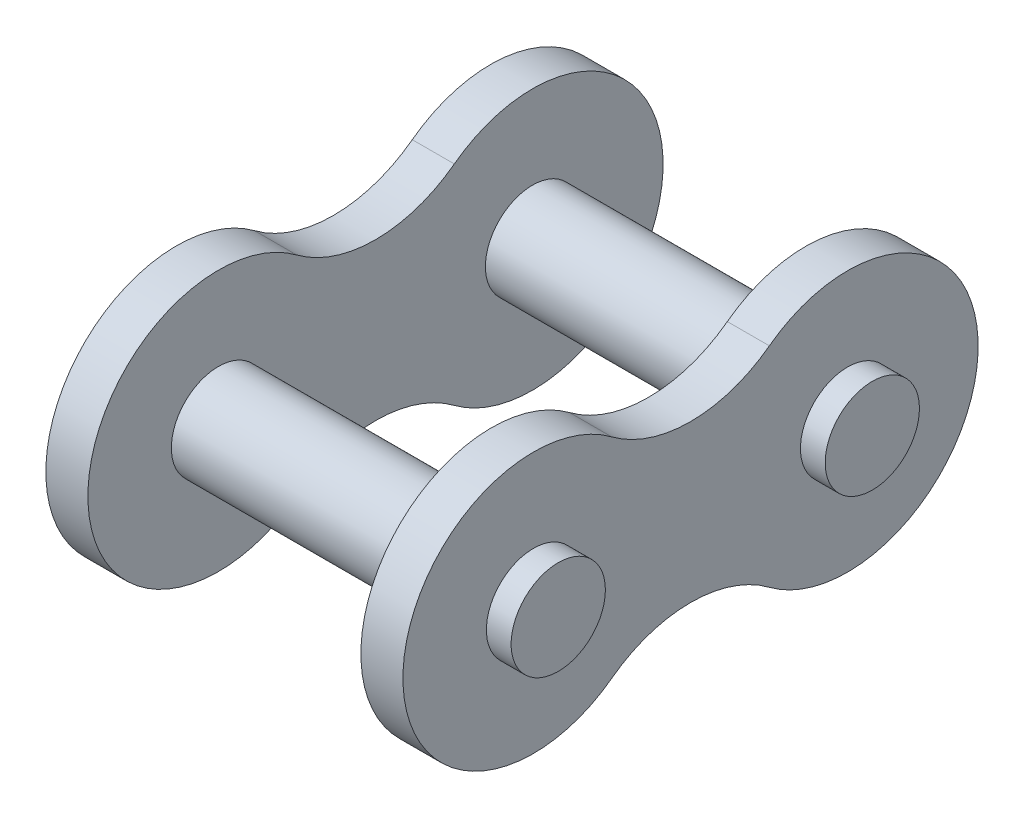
SolidWorks part; units mm, degrees
ref_plane "Płaszczyzna przednia" through (0, 0, 0) normal (0, 0, 1) x (1, 0, 0)
ref_plane "Płaszczyzna górna" through (0, 0, 0) normal (0, 1, 0) x (1, 0, 0)
ref_plane "Płaszczyzna prawa" through (0, 0, 0) normal (1, 0, 0) x (0, 0, -1)
sketch "Szkic1" plane through (0, 0, 0) normal (1, 0, 0) x (0, 0, -1)
  arc A0 (7.906, 10.5705) -> (7.906, -10.5705) centre (0, 0) ccw
  arc A1 (23.844, -10.5705) -> (7.906, -10.5705) centre (15.875, -21.2251) ccw
  arc A2 (7.906, 10.5705) -> (23.844, 10.5705) centre (15.875, 21.2251) ccw
  arc A3 (23.844, -10.5705) -> (23.844, 10.5705) centre (31.75, 0) ccw
  circle A4 centre (31.75, 0) radius 4.765
  circle A5 centre (0, 0) radius 4.765
extrude "Dodanie-wyciągnięcie1" add sketch "Szkic1" along normal blind 4.25
sketch "Szkic2" plane through (0, 0, 0) normal (1, 0, 0) x (0, 0, -1)
  circle A0 centre (0, 0) radius 4.765 construction
  circle A1 centre (31.75, 0) radius 4.765 construction
  circle A2 centre (0, 0) radius 4.765
  circle A3 centre (31.75, 0) radius 4.765
extrude "Dodanie-wyciągnięcie2" add sketch "Szkic2" along normal blind 38.6 and the other way blind 2.5
ref_plane "Płaszczyzna2" through (36.1, 0, 0) normal (1, 0, 0) x (0, 0, -1)
sketch "Szkic3" plane through (36.1, 0, 0) normal (1, 0, 0) x (0, 0, -1)
  arc A0 (23.844, -10.5705) -> (7.906, -10.5705) centre (15.875, -21.2251) ccw construction
  arc A1 (23.844, -10.5705) -> (23.844, 10.5705) centre (31.75, 0) ccw construction
  arc A2 (7.906, 10.5705) -> (23.844, 10.5705) centre (15.875, 21.2251) ccw construction
  arc A3 (7.906, 10.5705) -> (7.906, -10.5705) centre (0, 0) ccw construction
  arc A4 (23.844, -10.5705) -> (7.906, -10.5705) centre (15.875, -21.2251) ccw
  arc A5 (23.844, -10.5705) -> (23.844, 10.5705) centre (31.75, 0) ccw
  arc A6 (7.906, 10.5705) -> (23.844, 10.5705) centre (15.875, 21.2251) ccw
  arc A7 (7.906, 10.5705) -> (7.906, -10.5705) centre (0, 0) ccw
extrude "Dodanie-wyciągnięcie3" add sketch "Szkic3" against normal blind 4.25
ref_plane "Płaszczyzna3" through (18.05, 0, 0) normal (1, 0, 0) x (0, 0, -1)
sketch "Szkic4" plane through (18.05, 0, 0) normal (1, 0, 0) x (0, 0, -1)
  point P0 (31.75, 0)
  point P1 (0, 0)
  point P3 (12.9231, 20.209)
  point P5 (31.75, 0)
  point P6 (0, 0)
